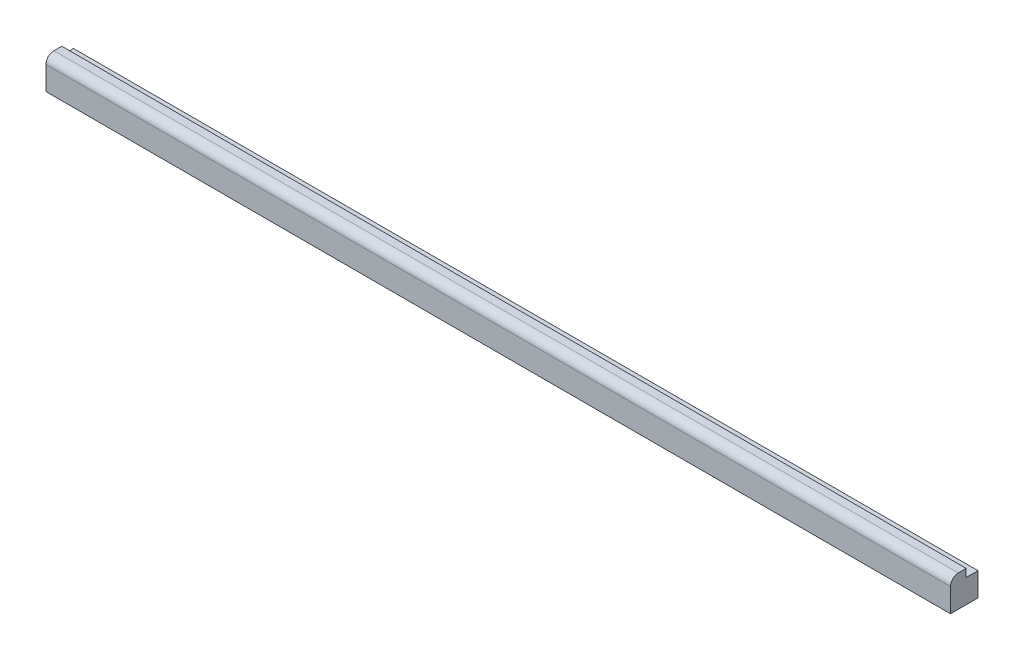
SolidWorks part; units mm, degrees
ref_plane "Front Plane" through (0, 0, 0) normal (0, 0, 1) x (1, 0, 0)
ref_plane "Top Plane" through (0, 0, 0) normal (0, 1, 0) x (1, 0, 0)
ref_plane "Right Plane" through (0, 0, 0) normal (1, 0, 0) x (0, 0, -1)
sketch "Sketch1" plane through (0, 0, 0) normal (1, 0, 0) x (0, 0, -1)
  line L1 (-11.1125, -12.7) -> (11.1125, -12.7)
  line L2 (-11.1125, -12.7) -> (-11.1125, 12.7)
  line L3 (-11.1125, 12.7) -> (11.1125, 12.7)
  line L4 (11.1125, -12.7) -> (11.1125, 12.7)
  line L5 (-11.1125, -12.7) -> (11.1125, 12.7) construction
  line L6 (-11.1125, 12.7) -> (11.1125, -12.7) construction
  point P0 (0, 0)
  dimension "D1" = 22.225
  dimension "D2" = 25.4
extrude "Boss-Extrude1" add sketch "Sketch1" along normal mid plane 730.25
fillet "Fillet1" radius 6.35 1 edges at (0, 12.7, 11.1125)
sketch "Sketch2" plane through (365.125, 0, 0) normal (1, 0, 0) x (0, 0, -1)
  line L1 (11.1125, 12.7) -> (1.5875, 12.7)
  line L2 (11.1125, 12.7) -> (11.1125, 6.35)
  line L3 (11.1125, 6.35) -> (1.5875, 6.35)
  line L4 (1.5875, 12.7) -> (1.5875, 6.35)
  dimension "D1" = 9.525
  dimension "D2" = 6.35
extrude "Cut-Extrude1" cut sketch "Sketch2" against normal through all
